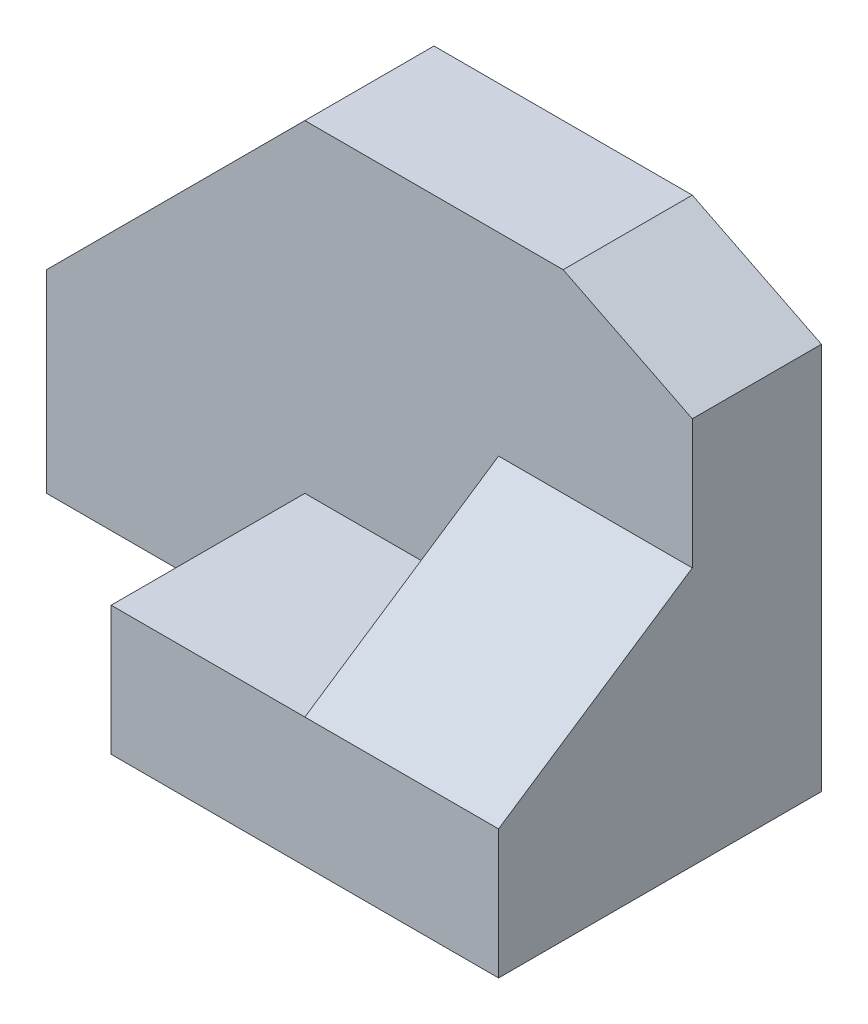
SolidWorks part; units mm, degrees
ref_plane "Alzado" through (0, 0, 0) normal (0, 0, 1) x (1, 0, 0)
ref_plane "Planta" through (0, 0, 0) normal (0, 1, 0) x (1, 0, 0)
ref_plane "Vista lateral" through (0, 0, 0) normal (1, 0, 0) x (0, 0, -1)
sketch "Croquis1" plane through (0, 0, 0) normal (0, 0, 1) x (1, 0, 0)
  line L0 (50, 35) -> (-50, -35) construction
  line L1 (-50, 35) -> (50, 35)
  line L2 (-50, 35) -> (-50, -35)
  line L3 (-50, -35) -> (50, -35)
  line L4 (50, 35) -> (50, -35)
  line L5 (50, -35) -> (-50, 35) construction
  dimension "D1" = 70
  dimension "D2" = 100
extrude "Saliente-Extruir1" add sketch "Croquis1" along normal mid plane 50
sketch "Croquis11" plane through (0, 0, 25) normal (0, 0, 1) x (1, 0, 0)
  line L0 (-50, -5) -> (-10, 35)
  line L1 (-50, 35) -> (-50, -35) construction
  line L2 (50, 35) -> (-50, 35) construction
  line L3 (-10, 35) -> (-50, 35)
  line L4 (-50, 35) -> (-50, -5)
  line L5 (30, 35) -> (50, 25)
  line L6 (50, -35) -> (50, 35) construction
  line L7 (50, 25) -> (50, 35)
  line L8 (50, 35) -> (30, 35)
  line L9 (-50, -35) -> (50, -35) construction
  dimension "D1" = 30
  dimension "D2" = 10
  dimension "D3" = 20
  dimension "D4" = 40
extrude "Cortar-Extruir9" cut sketch "Croquis11" against normal through all
sketch "Croquis12" plane through (-50, 0, 0) normal (-1, 0, 0) x (0, 0, 1)
  line L0 (-25, 35) -> (25, 35) construction
  line L1 (25, -35) -> (-5, -35)
  line L2 (25, -35) -> (25, 35)
  line L3 (25, 35) -> (-5, 35)
  line L4 (-5, -35) -> (-5, 35)
  dimension "D1" = 30
extrude "Cortar-Extruir10" cut sketch "Croquis12" against normal blind 40
sketch "Croquis13" plane through (-10, 0, 0) normal (-1, 0, 0) x (0, 0, 1)
  line L0 (25, -35) -> (25, 35) construction
  line L1 (-5, 35) -> (25, 35)
  line L2 (-5, 35) -> (-5, -15)
  line L3 (-5, -15) -> (25, -15)
  line L4 (25, 35) -> (25, -15)
  line L5 (-5, -35) -> (25, -35) construction
  dimension "D1" = 20
extrude "Cortar-Extruir11" cut sketch "Croquis13" against normal blind 30
sketch "Croquis14" plane through (20, 0, 0) normal (-1, 0, 0) x (0, 0, 1)
  line L0 (25, -15) -> (-5, 5)
  line L2 (-5, 5) -> (-5, 35)
  line L3 (-5, 35) -> (25, 35)
  line L4 (25, 35) -> (25, -15)
  dimension "D1" = 20
extrude "Cortar-Extruir12" cut sketch "Croquis14" against normal through all
